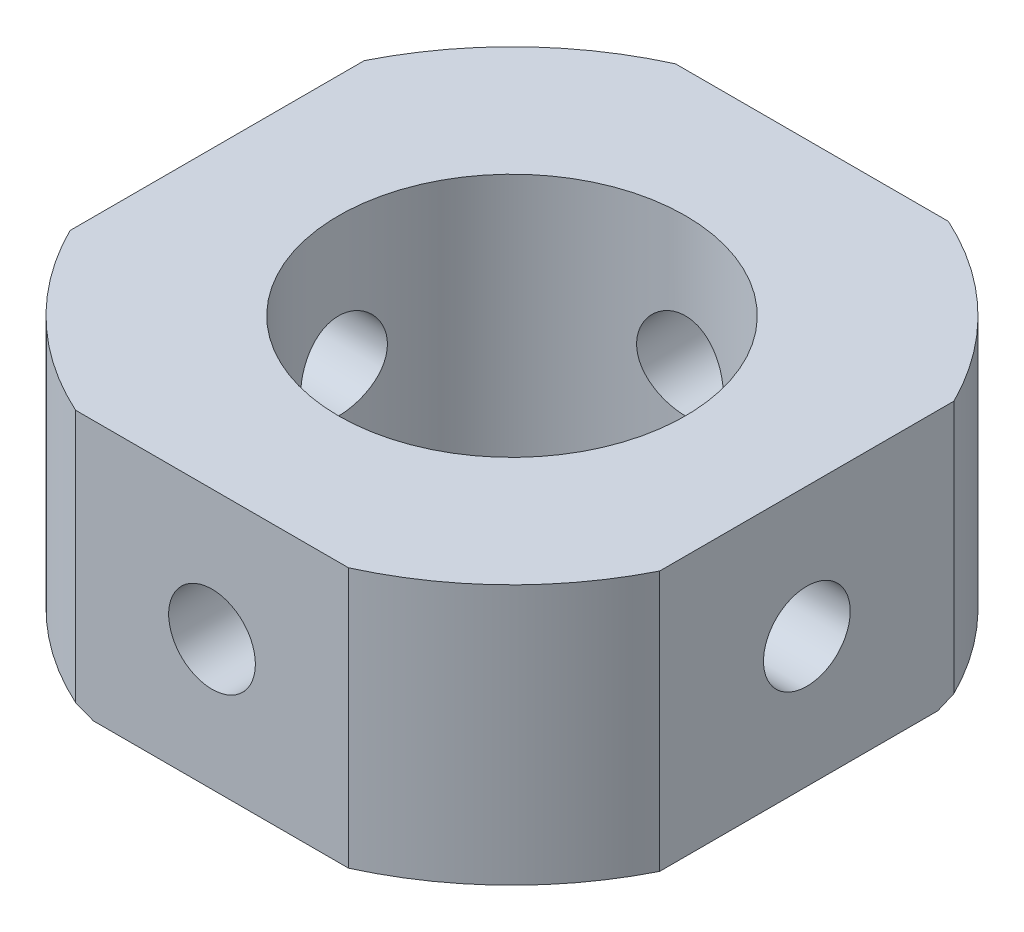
SolidWorks part; units mm, degrees
ref_plane "前视基准面" through (0, 0, 0) normal (0, 0, 1) x (1, 0, 0)
ref_plane "上视基准面" through (0, 0, 0) normal (0, 1, 0) x (1, 0, 0)
ref_plane "右视基准面" through (0, 0, 0) normal (1, 0, 0) x (0, 0, -1)
sketch "草图1" plane through (0, 0, 0) normal (0, 1, 0) x (1, 0, 0)
  circle A0 centre (0, 0) radius 9.5
  dimension "D1" = 19
extrude "凸台-拉伸1" add sketch "草图1" along normal mid plane 7.5
sketch "草图2" plane through (0, 3.75, 0) normal (0, 1, 0) x (1, 0, 0)
  circle A0 centre (0, 0) radius 5
  dimension "D1" = 10
extrude "切除-拉伸1" cut sketch "草图2" against normal through all
sketch "草图3" plane through (0, 3.75, 0) normal (0, 1, 0) x (1, 0, 0)
  line L1 (-8.5, -8.6477) -> (8.5, -8.6477)
  line L2 (-8.5, -8.6477) -> (-8.5, 8.6477)
  line L3 (-8.5, 8.6477) -> (8.5, 8.6477)
  line L4 (8.5, -8.6477) -> (8.5, 8.6477)
  line L5 (-8.5, -8.6477) -> (8.5, 8.6477) construction
  line L6 (-8.5, 8.6477) -> (8.5, -8.6477) construction
  point P0 (0, 0)
  dimension "D1" = 17
extrude "切除-拉伸2" cut sketch "草图3" against normal through all flip side to cut
hole_wizard "M3 螺纹孔1" positions "草图5" profile "草图4" tap size "M3" standard "GB"
sketch "草图5" plane through (8.5, 0, 0) normal (1, 0, 0) x (0, 0, -1)
  point P0 (0, 0)
sketch "草图4" plane through (8.5, 0, 0) normal (0, 1, 0) x (0, 0, -1)
  line L0 (0, 0) -> (0, 17)
  line L1 (0, 17) -> (1.25, 17)
  line L2 (1.25, 17) -> (1.25, 0)
  line L5 (1.25, 0) -> (0, 0)
  line L11 (0, -6.35) -> (0, 107.95) construction
  dimension "通孔螺纹孔钻头直径" = 2.5
  dimension "通孔螺纹孔钻头深度" = 17
chamfer "倒角2" distance 0.2 angle 45 2 edges at (-6.5951, -3.75, 6.8377) (6.5951, -3.75, -6.8377)
hole_wizard "M3 螺纹孔2" positions "草图7" profile "草图8" tap size "M3" standard "Iso"
sketch "草图7" plane through (0, 0, 8.6477) normal (0, 0, 1) x (1, 0, 0)
  point P0 (0, 0)
sketch "草图8" plane through (0, 0, 8.6477) normal (1, 0, 0) x (0, -1, 0)
  line L0 (0, 0) -> (0, 17.2953)
  line L1 (0, 17.2953) -> (1.25, 17.2953)
  line L2 (1.25, 17.2953) -> (1.25, 0)
  line L5 (1.25, 0) -> (0, 0)
  line L11 (0, -6.35) -> (0, 107.95) construction
  dimension "通孔螺纹孔钻头直径" = 2.5
  dimension "通孔螺纹孔钻头深度" = 17.2953
